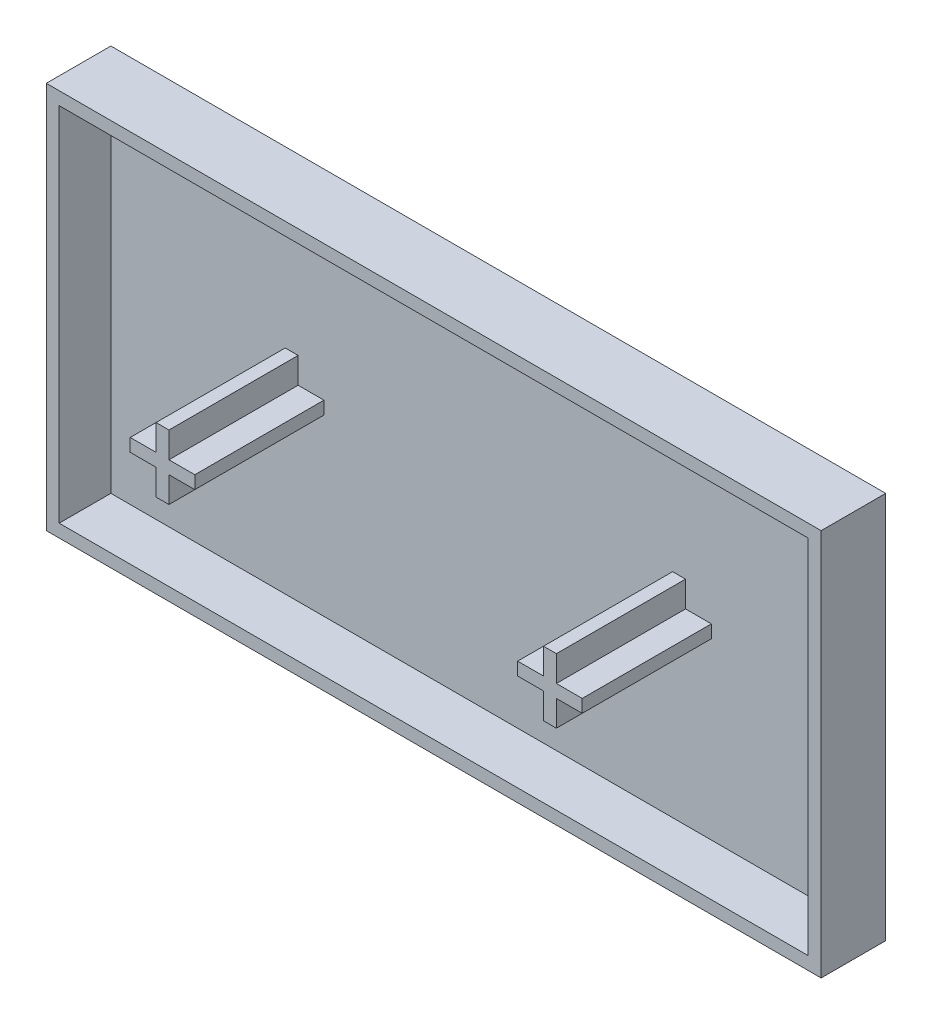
SolidWorks part; units mm, degrees
ref_plane "前视基准面" through (0, 0, 0) normal (0, 0, 1) x (1, 0, 0)
ref_plane "上视基准面" through (0, 0, 0) normal (0, 1, 0) x (1, 0, 0)
ref_plane "右视基准面" through (0, 0, 0) normal (1, 0, 0) x (0, 0, -1)
sketch "草图1" plane through (0, 0, 0) normal (0, 0, 1) x (1, 0, 0)
  line L1 (-30, 15) -> (30, 15)
  line L2 (-30, 15) -> (-30, -15)
  line L3 (-30, -15) -> (30, -15)
  line L4 (30, 15) -> (30, -15)
  dimension "D1" = 60
  dimension "D2" = 30
  dimension "D3" = 30
  dimension "D4" = 15
extrude "凸台-拉伸1" add sketch "草图1" along normal mid plane 5
shell "抽壳1" thickness 1
sketch "草图2" plane through (0, 0, -1.5) normal (0, 0, 1) x (1, 0, 0)
  line L0 (-14.5, 0.5) -> (-12.5, 0.5)
  line L1 (-17.5, 0.5) -> (-15.5, 0.5)
  line L2 (-17.5, 0.5) -> (-17.5, -0.5)
  line L3 (-17.5, -0.5) -> (-15.5, -0.5)
  line L4 (-12.5, 0.5) -> (-12.5, -0.5)
  line L5 (-15.5, 2.5) -> (-14.5, 2.5)
  line L6 (-15.5, 2.5) -> (-15.5, 0.5)
  line L7 (-15.5, -2.5) -> (-14.5, -2.5)
  line L8 (-14.5, 2.5) -> (-14.5, 0.5)
  line L9 (-15.5, -0.5) -> (-15.5, -2.5)
  line L10 (-14.5, -0.5) -> (-12.5, -0.5)
  line L11 (-14.5, -0.5) -> (-14.5, -2.5)
  line L12 (-15, 2.5) -> (-15, -2.5) construction
  line L13 (-15, -2.5) -> (-17.5, 0) construction
  line L14 (-17.5, 0) -> (-12.5, 0) construction
  line L15 (-30, 15) -> (-30, -15) construction
  line L16 (30, 15) -> (-30, 15) construction
  line L17 (0, 13.4066) -> (0, -10.7931) construction
  line L18 (17.5, 0) -> (12.5, 0) construction
  line L19 (15, -2.5) -> (17.5, 0) construction
  line L20 (15, 2.5) -> (15, -2.5) construction
  line L21 (14.5, -0.5) -> (14.5, -2.5)
  line L22 (14.5, -0.5) -> (12.5, -0.5)
  line L23 (15.5, -0.5) -> (15.5, -2.5)
  line L24 (14.5, 2.5) -> (14.5, 0.5)
  line L25 (15.5, -2.5) -> (14.5, -2.5)
  line L26 (15.5, 2.5) -> (15.5, 0.5)
  line L27 (15.5, 2.5) -> (14.5, 2.5)
  line L28 (12.5, 0.5) -> (12.5, -0.5)
  line L29 (17.5, -0.5) -> (15.5, -0.5)
  line L30 (17.5, 0.5) -> (17.5, -0.5)
  line L31 (17.5, 0.5) -> (15.5, 0.5)
  line L32 (14.5, 0.5) -> (12.5, 0.5)
  dimension "D1" = 1
  dimension "D2" = 1
  dimension "D3" = 5
  dimension "D4" = 5
  dimension "D5" = 2
  dimension "D6" = 2
  dimension "D7" = 15
  dimension "D8" = 15
extrude "凸台-拉伸2" add sketch "草图2" along normal blind 10
